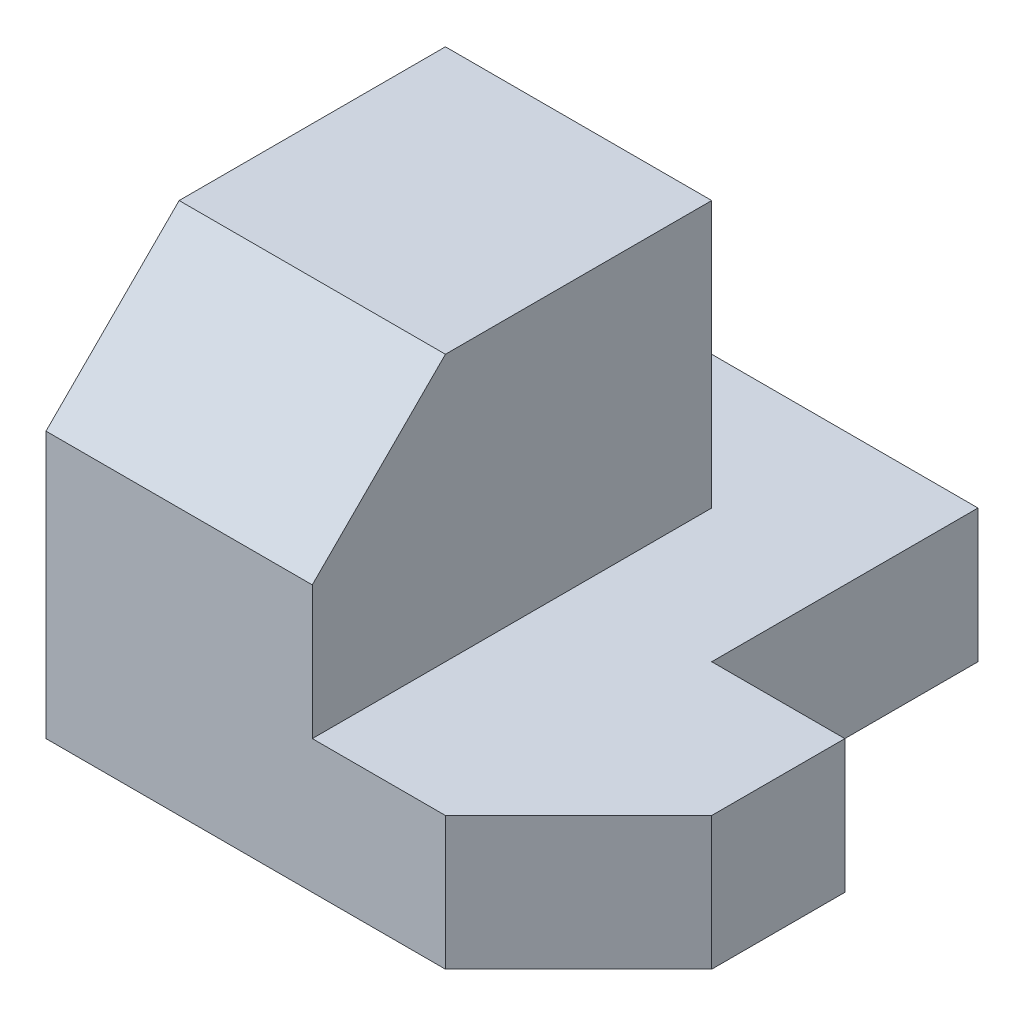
SolidWorks part; units mm, degrees
ref_plane "Front Plane" through (0, 0, 0) normal (0, 0, 1) x (1, 0, 0)
ref_plane "Top Plane" through (0, 0, 0) normal (0, 1, 0) x (1, 0, 0)
ref_plane "Right Plane" through (0, 0, 0) normal (1, 0, 0) x (0, 0, -1)
sketch "Sketch1" plane through (0, 0, 0) normal (0, 1, 0) x (1, 0, 0)
  line L0 (0, 0) -> (0, -40)
  line L1 (0, -40) -> (30, -40)
  line L2 (30, -40) -> (40, -30)
  line L3 (40, -30) -> (40, -20)
  line L4 (40, -20) -> (30, -20)
  line L5 (30, -20) -> (30, 0)
  line L6 (30, 0) -> (0, 0)
  dimension "D1" = 30
  dimension "D2" = 10
  dimension "D3" = 40
  dimension "D4" = 30
  dimension "D5" = 10
  dimension "D6" = 20
extrude "Extrude1" add sketch "Sketch1" along normal blind 10
sketch "Sketch2" plane through (0, 10, 0) normal (0, 1, 0) x (1, 0, 0)
  line L1 (0, -40) -> (20, -40)
  line L2 (0, -40) -> (0, -10)
  line L3 (0, -10) -> (20, -10)
  line L4 (20, -40) -> (20, -10)
  dimension "D1" = 20
  dimension "D2" = 30
extrude "Extrude2" add sketch "Sketch2" along normal blind 20
chamfer "Chamfer1" distance 10 angle 45 1 edges at (10, 30, 40)
